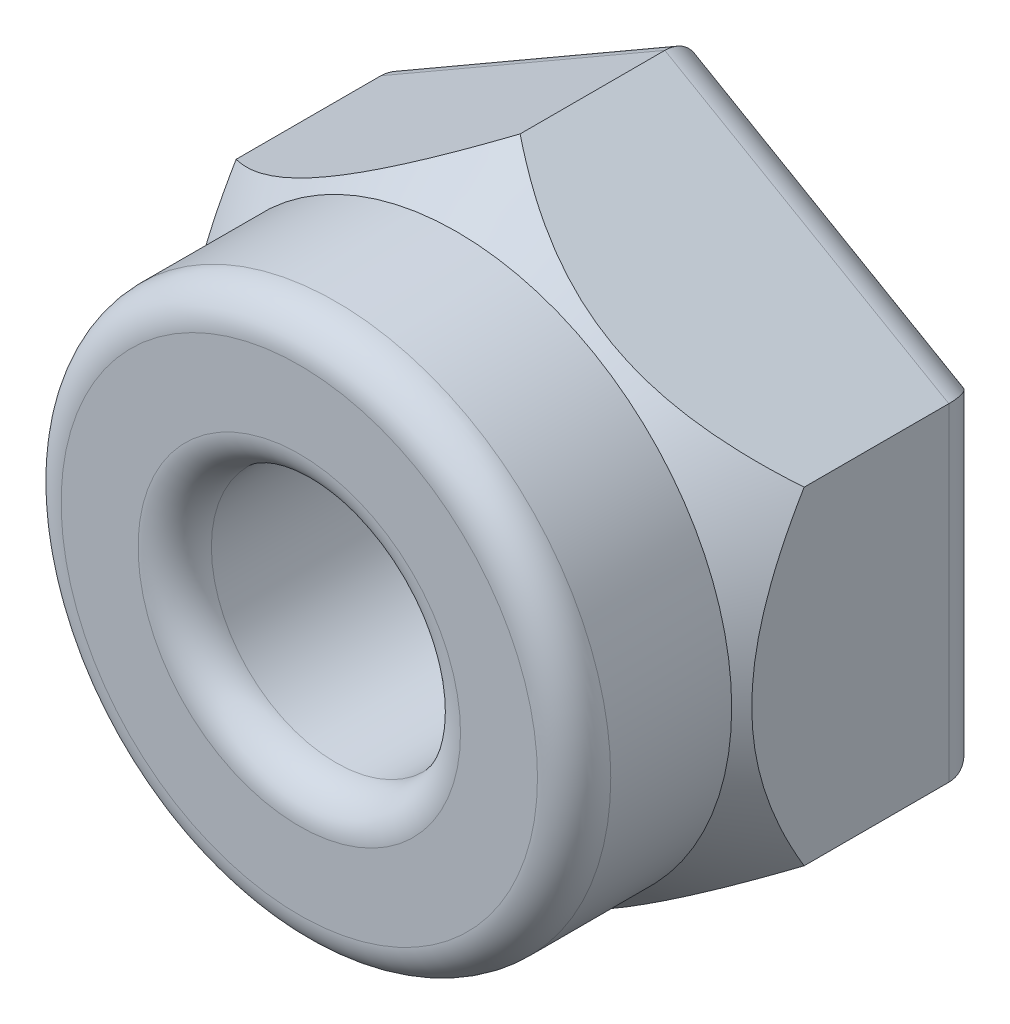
SolidWorks part; units mm, degrees
ref_plane "Front Plane" through (0, 0, 0) normal (0, 0, 1) x (1, 0, 0)
ref_plane "Top Plane" through (0, 0, 0) normal (0, 1, 0) x (1, 0, 0)
ref_plane "Right Plane" through (0, 0, 0) normal (1, 0, 0) x (0, 0, -1)
sketch "Sketch1" plane through (0, 0, 0) normal (0, 0, 1) x (1, 0, 0)
  line L1 (0, -4.5461) -> (3.937, -2.273)
  line L2 (3.937, -2.273) -> (3.937, 2.273)
  line L3 (3.937, 2.273) -> (0, 4.5461)
  line L4 (0, 4.5461) -> (-3.937, 2.273)
  line L5 (-3.937, 2.273) -> (-3.937, -2.273)
  line L6 (-3.937, -2.273) -> (0, -4.5461)
  line L7 (0, -2.0955) -> (0, 2.0955) construction
  circle A0 centre (0, 0) radius 3.937 construction
  dimension "Hex Width" = 7.874
extrude "Hex" add sketch "Sketch1" along normal blind 3.3909
sketch "Sketch2" plane through (0, 0, 3.3909) normal (0, 0, 1) x (1, 0, 0)
  circle A0 centre (0, 0) radius 3.81
  dimension "D1" = 7.62
extrude "Locking" add sketch "Sketch2" along normal blind 2.1844
sketch "Sketch3" plane through (0, 0, 5.5753) normal (0, 0, 1) x (1, 0, 0)
  circle A0 centre (0, 0) radius 1.7272
  dimension "D1" = 3.4544
extrude "Thread" cut sketch "Sketch3" against normal through all
sketch "Sketch4" plane through (0, 0, 0) normal (1, 0, 0) x (0, 0, -1)
  line L0 (-3.3909, 3.81) -> (-2.5137, 4.5461)
  line L1 (-3.3909, 3.81) -> (-3.3909, -3.81) construction
  line L2 (-3.3909, 4.5461) -> (0, 4.5461) construction
  line L3 (-2.5137, 4.5461) -> (-3.3909, 4.5461)
  line L4 (-3.3909, 4.5461) -> (-3.3909, 3.81)
  line L5 (-5.7453, 0) -> (3.2692, 0) construction
  line L6 (2.0955, 0) -> (-2.0955, 0) construction
  line L9 (-3.3909, 3.81) -> (-3.3909, -3.81) construction
  line L11 (-5.5753, 3.81) -> (-5.5753, -3.81) construction
  line L12 (-5.5753, 3.81) -> (-5.5753, -3.81) construction
  line L13 (-5.5753, 3.81) -> (-3.3909, 3.81) construction
  dimension "D2" = 50
revolve "Cut-Revolve3" cut sketch "Sketch4" angle 360 about L5
fillet "Fillet2" radius 0.508
fillet "Fillet3" radius 0.508
fillet "Fillet4" radius 0.508
